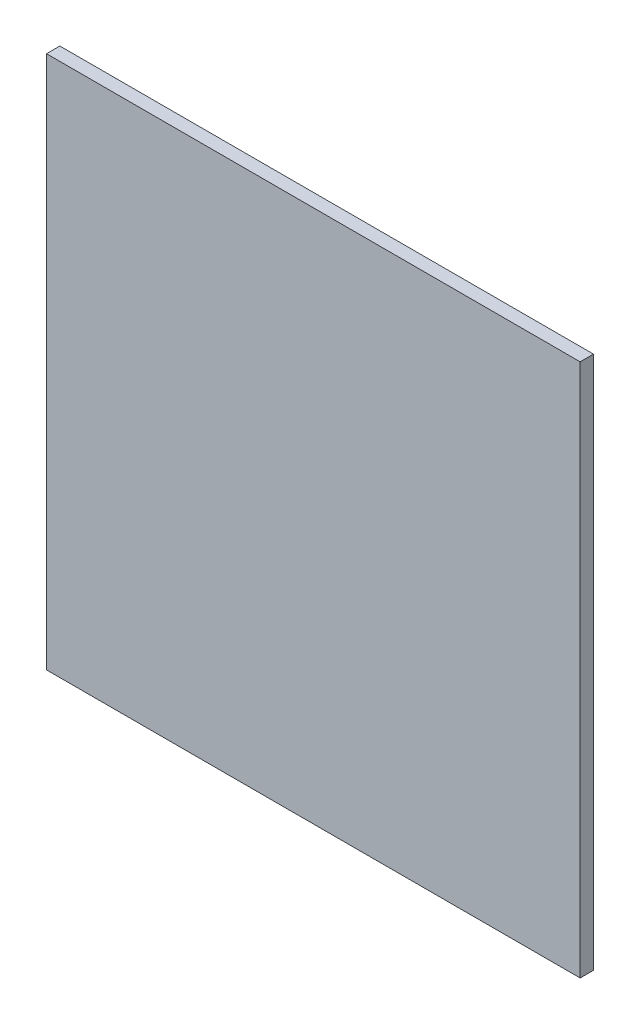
SolidWorks part; units mm, degrees
ref_plane "Front Plane" through (0, 0, 0) normal (0, 0, 1) x (1, 0, 0)
ref_plane "Top Plane" through (0, 0, 0) normal (0, 1, 0) x (1, 0, 0)
ref_plane "Right Plane" through (0, 0, 0) normal (1, 0, 0) x (0, 0, -1)
sketch "Sketch1" plane through (0, 0, 0) normal (0, 1, 0) x (1, 0, 0)
  line L1 (100, 2.5) -> (-100, 2.5)
  line L2 (100, 2.5) -> (100, -2.5)
  line L3 (100, -2.5) -> (-100, -2.5)
  line L4 (-100, 2.5) -> (-100, -2.5)
  line L5 (100, 2.5) -> (-100, -2.5) construction
  line L6 (100, -2.5) -> (-100, 2.5) construction
  point P0 (0, 0)
  dimension "D1" = 5
  dimension "D2" = 200
extrude "Boss-Extrude1" add sketch "Sketch1" along normal blind 200
